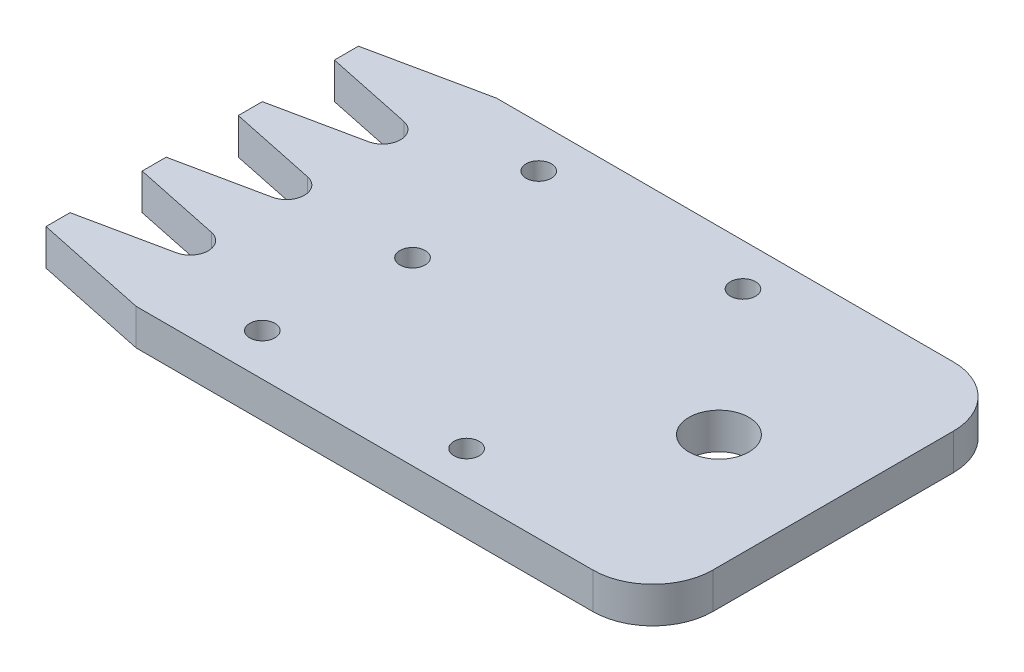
SolidWorks part; units mm, degrees
ref_plane "Front Plane" through (0, 0, 0) normal (0, 0, 1) x (1, 0, 0)
ref_plane "Top Plane" through (0, 0, 0) normal (0, 1, 0) x (1, 0, 0)
ref_plane "Right Plane" through (0, 0, 0) normal (1, 0, 0) x (0, 0, -1)
sketch "Sketch1" plane through (0, 0, 0) normal (0, 1, 0) x (1, 0, 0)
  line L0 (105, 30) -> (0, 30) construction
  line L1 (19, 0) -> (95, 0)
  line L2 (0, 4) -> (0, 8)
  line L3 (19, 60) -> (95, 60)
  line L4 (105, 10) -> (105, 50)
  line L5 (19, 60) -> (19, 0) construction
  line L6 (19, 60) -> (0, 56)
  line L7 (19, 0) -> (0, 4)
  line L8 (14, 58.9474) -> (14, 1.0526) construction
  line L9 (0, 52) -> (14.6155, 48.9362)
  line L10 (0, 40) -> (14.6155, 43.0638)
  line L11 (0, 36) -> (14.6155, 32.9362)
  line L12 (0, 24) -> (14.6155, 27.0638)
  line L13 (0, 20) -> (14.6155, 16.9362)
  line L14 (0, 8) -> (14.6155, 11.0638)
  line L15 (0, 52) -> (0, 56)
  line L16 (0, 36) -> (0, 40)
  line L17 (0, 20) -> (0, 24)
  line L18 (19, 0) -> (0, 0) construction
  line L19 (0, 0) -> (0, 4) construction
  line L20 (0, 8) -> (0, 20) construction
  line L21 (0, 24) -> (0, 36) construction
  line L22 (0, 40) -> (0, 52) construction
  circle A0 centre (86, 30) radius 5
  arc A1 (105, 50) -> (95, 60) centre (95, 50) ccw
  arc A2 (95, 0) -> (105, 10) centre (95, 10) ccw
  arc A3 (14.6155, 43.0638) -> (14.6155, 48.9362) centre (14, 46) ccw
  arc A4 (14.6155, 27.0638) -> (14.6155, 32.9362) centre (14, 30) ccw
  arc A5 (14.6155, 11.0638) -> (14.6155, 16.9362) centre (14, 14) ccw
  point P13 (105, 0)
  dimension "D3" = 10
  dimension "D4" = 19
  dimension "D5" = 10
  dimension "D8" = 6
  dimension "D10" = 16
  dimension "D11" = 6
  dimension "D2" = 14
  dimension "D6" = 19
  dimension "D7" = 4
  dimension "D9" = 16
  dimension "D12" = 4
  dimension "D13" = 4
  dimension "D14" = 4
  dimension "D15" = 105
  dimension "D16" = 60
  dimension "D17" = 12
  dimension "D18" = 12
  dimension "D19" = 4
  dimension "D20" = 4
extrude "Extrude1" add sketch "Sketch1" along normal blind 6
sketch "Sketch2" plane through (0, 6, 0) normal (0, 1, 0) x (1, 0, 0)
  line L0 (0, 56) -> (0, 52) construction
  line L1 (0, 40) -> (0, 36) construction
  line L2 (0, 24) -> (0, 20) construction
  line L3 (95, 60) -> (19, 60) construction
  line L4 (19, 0) -> (95, 0) construction
  arc A0 (14.6155, 43.0638) -> (14.6155, 48.9362) centre (14, 46) ccw construction
  point P0 (33, 53)
  point P1 (35, 30)
  point P2 (33, 7)
  point P3 (67, 53)
  point P4 (67, 7)
  point P15 (17, 46)
  dimension "D1" = 33
  dimension "D2" = 35
  dimension "D3" = 33
  dimension "D4" = 34
  dimension "D5" = 34
  dimension "D6" = 7
  dimension "D7" = 7
  dimension "D8" = 7
  dimension "D9" = 7
  dimension "D10" = 16
hole_wizard "M5 Tapped Hole1" positions "3DSketch1" profile "Sketch3" tap size "M5" standard "ISO"
sketch3d "3DSketch1"
  point P0 (33, 6, -53)
  point P3 (35, 6, -30)
  point P6 (33, 6, -7)
  point P9 (67, 6, -7)
  point P12 (67, 6, -53)
sketch "Sketch3" plane through (33, 6, -53) normal (1, 0, 0) x (0, 0, 1)
  line L0 (0, 0) -> (0, 6)
  line L1 (0, 6) -> (2.1, 6)
  line L2 (2.1, 6) -> (2.1, 0)
  line L5 (2.1, 0) -> (0, 0)
  line L11 (0, -6.35) -> (0, 107.95) construction
  dimension "Thru Tap Drill Dia." = 4.2
  dimension "Thru Tap Drill Depth" = 6
